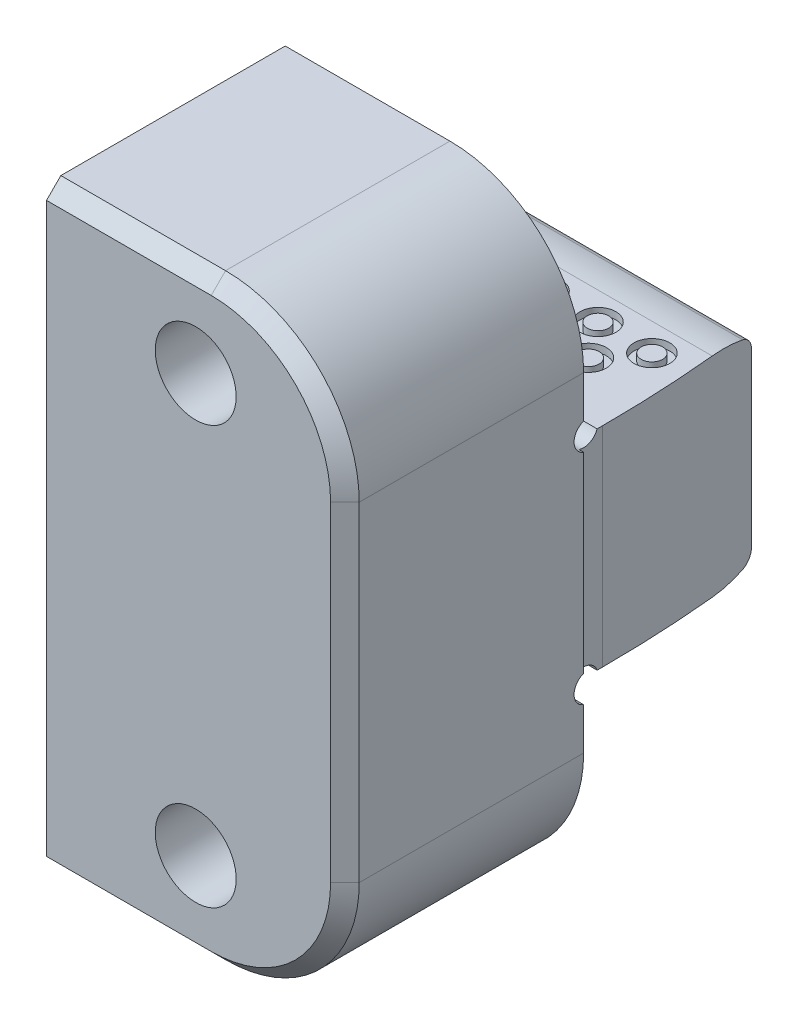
SolidWorks part; units mm, degrees
ref_plane "Front Plane" through (0, 0, 0) normal (0, 0, 1) x (1, 0, 0)
ref_plane "Top Plane" through (0, 0, 0) normal (0, 1, 0) x (1, 0, 0)
ref_plane "Right Plane" through (0, 0, 0) normal (1, 0, 0) x (0, 0, -1)
sketch "Sketch3" plane through (0, 0, 0) normal (1, 0, 0) x (0, 0, -1)
  line L0 (0, 8.7312) -> (0, -8.7312) construction
  line L1 (-12.7, -15.875) -> (0, -15.875)
  line L2 (-12.7, -15.875) -> (-12.7, 15.875)
  line L3 (-12.7, 15.875) -> (0, 15.875)
  line L4 (9.7536, -5.5601) -> (9.7536, 5.5601)
  line L6 (0, -15.875) -> (0, -5.5601)
  line L7 (0, -5.5601) -> (9.7536, -5.5601)
  line L8 (0, 15.875) -> (0, 5.5601)
  line L9 (0, 5.5601) -> (9.7536, 5.5601)
  line L10 (0, 0) -> (50000, 0) construction
  dimension "D1" = 22.4536
  dimension "D2" = 12.7
  dimension "D3" = 31.75
  dimension "D4" = 11.1201
extrude "Extrude1" add sketch "Sketch3" along normal mid plane 15.875
sketch "Sketch7" plane through (7.9375, 0, 0) normal (1, 0, 0) x (0, 0, -1)
  line L1 (0, -14.5526) -> (21.9683, -14.5526)
  line L2 (0, -14.5526) -> (0, 17.1683)
  line L3 (0, 17.1683) -> (21.9683, 17.1683)
  line L4 (21.9683, -14.5526) -> (21.9683, 17.1683)
  line L5 (0, -15.875) -> (0, -5.5601) construction
extrude "Cut-Extrude3" cut sketch "Sketch7" against normal blind 0.254
sketch "Sketch8" plane through (7.9375, 0, 0) normal (1, 0, 0) x (0, 0, -1)
  line L0 (0, 0) -> (50000, 0) construction
  line L1 (0, -15.875) -> (0, 15.875) construction
  line L2 (0, 5.5601) -> (9.7536, 5.5601) construction
  circle A0 centre (0.254, 5.8141) radius 0.762
  circle A1 centre (0.254, -5.8141) radius 0.762
  dimension "D1" = 0.762
  dimension "D2" = 0.508
  dimension "D3" = 0.508
extrude "Cut-Extrude4" cut sketch "Sketch8" against normal through all
sketch "Sketch9" plane through (7.9375, 0, 0) normal (1, 0, 0) x (0, 0, -1)
  line L0 (0.9724, 5.5601) -> (9.7536, 5.5601) construction
  line L1 (9.7536, 5.5601) -> (9.7536, -5.5601) construction
  line L2 (0, 0) -> (50000, 0) construction
  line L3 (9.7536, 4.564) -> (13.7414, 4.564)
  line L4 (7.3914, 5.5601) -> (7.3914, 10.914)
  line L5 (7.3914, 10.914) -> (13.7414, 10.914)
  line L6 (13.7414, 4.564) -> (13.7414, 10.914)
  line L7 (13.7414, -4.564) -> (13.7414, -10.914)
  line L8 (7.3914, -10.914) -> (13.7414, -10.914)
  line L9 (7.3914, -5.5601) -> (7.3914, -10.914)
  line L10 (9.7536, -4.564) -> (13.7414, -4.564)
  arc A0 (7.3914, 5.5601) -> (9.2098, 5.2941) centre (7.3914, -0.7899) cw
  arc A1 (9.2098, 5.2941) -> (9.7536, 4.564) centre (8.9916, 4.564) cw
  arc A2 (9.2098, -5.2941) -> (9.7536, -4.564) centre (8.9916, -4.564) ccw
  arc A3 (7.3914, -5.5601) -> (9.2098, -5.2941) centre (7.3914, 0.7899) ccw
  dimension "D1" = 0.762
  dimension "D2" = 6.35
  dimension "D3" = 2.3622
  dimension "D4" = 6.35
  dimension "D5" = 6.35
extrude "Cut-Extrude5" cut sketch "Sketch9" against normal through all
sketch "Sketch13" plane through (0, 15.875, 0) normal (0, 1, 0) x (1, 0, 0)
  line L0 (7.6835, 0.9724) -> (7.6835, 7.3914) construction
  line L1 (0, 0) -> (0, 50000) construction
  line L2 (6.4005, 13.97) -> (19.1005, 13.97)
  line L4 (7.6835, 1.27) -> (19.1005, 1.27)
  line L5 (19.1005, 13.97) -> (19.1005, 1.27)
  arc A0 (6.4005, 13.97) -> (7.6835, 1.27) centre (-55.8165, 1.27) cw
  dimension "D1" = 63.5
  dimension "D2" = 1.27
  dimension "D3" = 12.7
  dimension "D4" = 12.7
extrude "Cut-Extrude6" cut sketch "Sketch13" against normal through all
sketch "Sketch15" plane through (0, 5.5601, 0) normal (0, 1, 0) x (1, 0, 0)
  line L2 (7.9375, -12.7) -> (-7.9375, -12.7) construction
  line L3 (-7.9375, 7.3914) -> (-7.9375, 0.9724) construction
  circle A0 centre (-2.9591, 5.9182) radius 0.9525
  circle A1 centre (-2.9591, 5.9182) radius 0.5715
  circle A2 centre (-0.0889, 5.9182) radius 0.9525
  circle A3 centre (-0.0889, 5.9182) radius 0.5715
  circle A4 centre (-5.8293, 5.9182) radius 0.9525
  circle A5 centre (-5.8293, 5.9182) radius 0.5715
  circle A6 centre (2.7813, 5.9182) radius 0.9525
  circle A7 centre (2.7813, 5.9182) radius 0.5715
  circle A8 centre (5.6515, 5.9182) radius 0.9525
  circle A9 centre (5.6515, 5.9182) radius 0.5715
  circle A10 centre (-1.5621, 4.0132) radius 0.9525
  circle A11 centre (-1.5621, 4.0132) radius 0.5715
  circle A12 centre (1.3081, 4.0132) radius 0.9525
  circle A13 centre (1.3081, 4.0132) radius 0.5715
  circle A14 centre (-4.4323, 4.0132) radius 0.9525
  circle A15 centre (-4.4323, 4.0132) radius 0.5715
  circle A16 centre (4.1783, 4.0132) radius 0.9525
  circle A17 centre (4.1783, 4.0132) radius 0.5715
  dimension "D1" = 18.6182
  dimension "D2" = 1.905
  dimension "D12" = 2.8702
  dimension "D7" = 1.905
  dimension "D8" = 1.143
  dimension "D3" = 2.1082
  dimension "D4" = 1.397
  dimension "D5" = 2.8702
  dimension "D6" = 2.8702
  dimension "D9" = 2.8702
  dimension "D10" = 2.8702
  dimension "D11" = 2.8702
  dimension "D13" = 2.8702
extrude "Cut-Extrude7" cut sketch "Sketch15" against normal blind 0.381
mirror "Mirror1" about plane through (0, 0, 0) normal (0, 1, 0) of "Cut-Extrude7"
hole_wizard "#6 CBORE" positions "Sketch11" profile "Sketch10" counterbore size "#6" standard "Ansi Inch"
sketch "Sketch11" plane through (0, 0, 0) normal (0, 0, -1) x (-1, 0, 0)
  line L0 (0, 0) -> (0, 50000) construction
  line L1 (0, 0) -> (50000, 0) construction
  point P0 (0, 11.1125)
  point P10 (0, -11.1125)
  dimension "D1" = 22.225
sketch "Sketch10" plane through (0, 11.1125, 0) normal (1, 0, 0) x (0, 1, 0)
  line L0 (0, 0) -> (0, 12.7)
  line L1 (0, 12.7) -> (2.1526, 12.7)
  line L3 (2.1526, 12.7) -> (2.1526, 4.299)
  line L4 (2.1526, 4.299) -> (3.5725, 4.299)
  line L5 (3.5725, 4.299) -> (3.5725, 0)
  line L7 (3.5725, 0) -> (0, 0)
  line L11 (0, -6.35) -> (0, 107.95) construction
  dimension "Thru Hole Dia." = 4.3053
  dimension "Thru Hole Depth" = 12.7
  dimension "C'Bore Dia." = 7.145
  dimension "C'Bore Depth" = 4.299
fillet "Fillet1" radius 7.112 2 edges at (7.9375, -15.875, 6.35) (7.9375, 15.875, 6.35)
chamfer "Chamfer1" distance 0.762 angle 45 5 edges at (-3.556, 15.875, 12.7) (-3.556, -15.875, 12.7) (7.9375, 0, 12.7) (5.8544, 13.7919, 12.7) (5.8544, -13.7919, 12.7)
